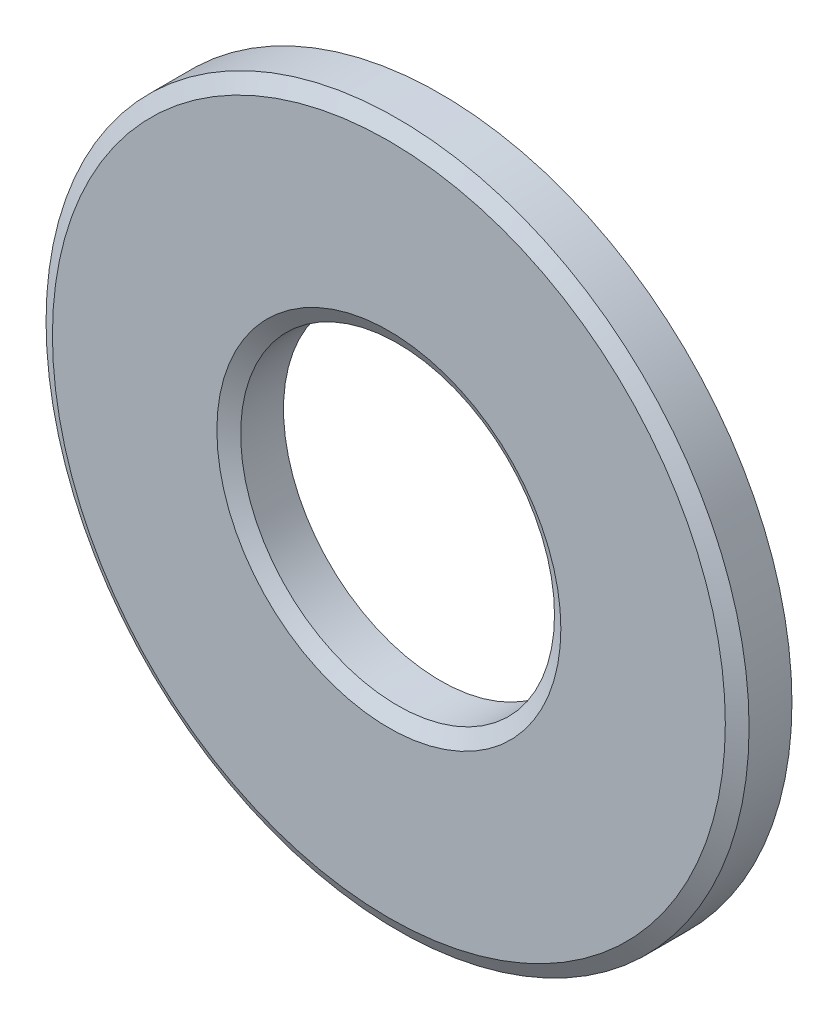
SolidWorks part; units mm, degrees
ref_plane "Plan1" through (0, 0, 0) normal (0, 0, 1) x (1, 0, 0)
ref_plane "Plan2" through (0, 0, 0) normal (0, 1, 0) x (1, 0, 0)
ref_plane "Plan3" through (0, 0, 0) normal (1, 0, 0) x (0, 0, -1)
sketch "Esquisse1" plane through (0, 0, 0) normal (0, 0, 1) x (1, 0, 0)
  circle A0 centre (0, 0) radius 7
  circle A1 centre (0, 0) radius 3.125
  dimension "D1" = 14
  dimension "D2" = 6.25
extrude "Base-Extrusion" add sketch "Esquisse1" along normal blind 1.2
chamfer "Chanfrein1" distance 0.3 angle 30
